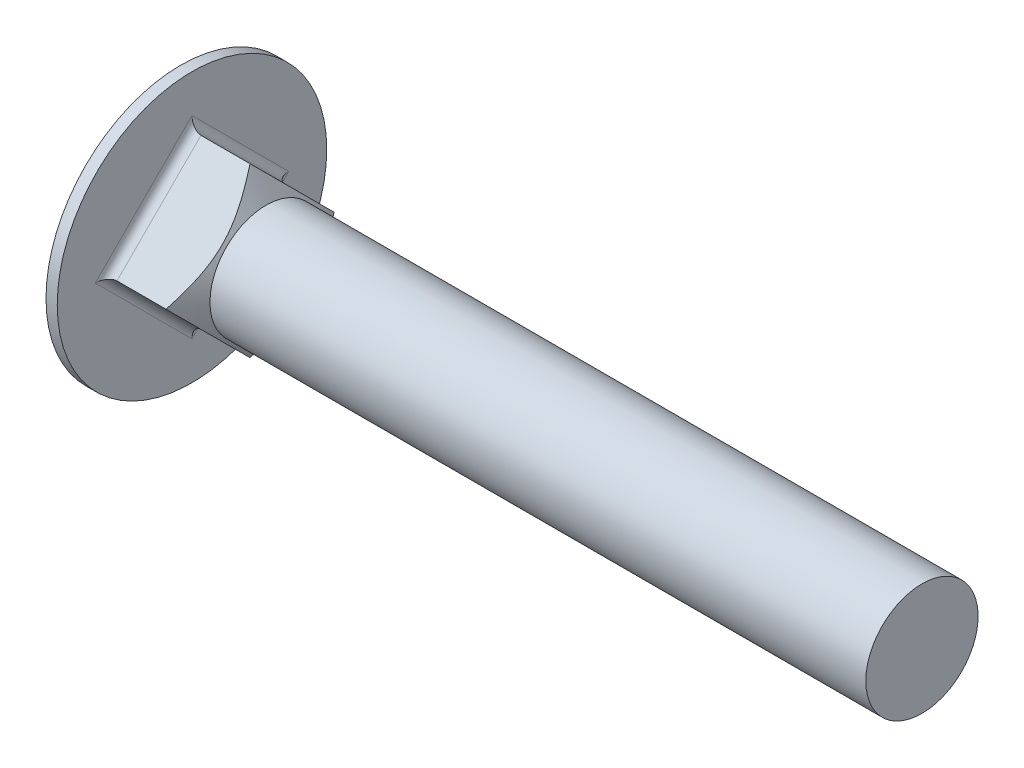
SolidWorks part; units mm, degrees
ref_plane "Front" through (0, 0, 0) normal (0, 0, 1) x (1, 0, 0)
ref_plane "Top" through (0, 0, 0) normal (0, 1, 0) x (1, 0, 0)
ref_plane "Right" through (0, 0, 0) normal (1, 0, 0) x (0, 0, -1)
other "Configuration Table"
sketch "Sketch1" plane through (0, 0, 0) normal (0, 0, 1) x (1, 0, 0)
  line L0 (-9.8282, 0) -> (16.3483, 0) construction
  line L1 (4, 12) -> (5, 12)
  line L2 (0, 0) -> (5, 0)
  line L3 (5, 12) -> (5, 0)
  arc A0 (4, 12) -> (0, 0) centre (20, 0) ccw
revolve "BaseHead" add sketch "Sketch1" angle 360 about L0
sketch "Sketch2" plane through (5, 0, 0) normal (1, 0, 0) x (0, 0, -1)
  line L1 (-7.4812, 0) -> (0, -7.4812)
  line L2 (0, -7.4812) -> (7.4812, 0)
  line L3 (7.4812, 0) -> (0, 7.4812)
  line L4 (0, 7.4812) -> (-7.4812, 0)
  circle A0 centre (0, 0) radius 5.29 construction
  dimension "Ss" = 10.58
extrude "Neck" add sketch "Sketch2" along normal blind 6.6
sketch "Sketch3" plane through (0, 0, 0) normal (0, 0, 1) x (1, 0, 0)
  line L0 (5, 0) -> (14.6279, 0) construction
  line L1 (11.6, 7.4812) -> (10.1675, 7.4812)
  line L3 (10.1675, 7.4812) -> (11.6, 5)
  line L5 (11.6, 5) -> (11.6, 7.4812)
  dimension "D1" = 30
revolve "Cut-Revolve1" cut sketch "Sketch3" angle 360 about L0
fillet "HeadFillet" radius 0.8 4 edges at (5, 3.7406, -3.7406) (5, -3.7406, -3.7406) (5, -3.7406, 3.7406) (5, 3.7406, 3.7406)
sketch "Sketch4" plane through (0, 0, 0) normal (0, 1, 0) x (1, 0, 0)
  line L0 (-12.2854, 0) -> (59.7905, 0) construction
  line L1 (70, 5) -> (44, 5)
  line L3 (44, 5) -> (11.6, 5)
  line L4 (5, -12) -> (5, 12) construction
  line L5 (70, 5) -> (70, 0)
  line L6 (70, 0) -> (11.6, 0)
  line L7 (11.6, 0) -> (11.6, 5)
  line L10 (11.6, -5) -> (11.6, 5) construction
revolve "Revolve1" add sketch "Sketch4" angle 360 about L0
sketch "Sketch5" plane through (0, 0, 0) normal (0, 0, 1) x (1, 0, 0)
  line L0 (69.594, 5.2) -> (70.406, 5.2)
  line L1 (70.406, 5.2) -> (70.406, 5)
  line L2 (70.406, 5) -> (70, 4.2968)
  line L3 (69.594, 5) -> (70, 4.2968)
  line L4 (69.594, 5.2) -> (69.594, 5)
  line L5 (-65.6461, 0) -> (65.6461, 0) construction
  line L6 (69.594, 5) -> (70.406, 5) construction
  line L7 (70, 5) -> (70, 4.2968) construction
  line L8 (70, -5) -> (70, 5) construction
  line L10 (70, 5) -> (11.6, 5) construction
  point P5 (70, 5.2)
revolve "Cut-Revolve10" [suppressed] cut sketch "Sketch5" angle 360 about L5
pattern_linear "LPattern10" [suppressed] count 27 spacing 0.9744 along (1, 0, 0)
equation "\"D2@Sketch5\" =  ( \"d@Sketch4\" - \"dn@ThreadCosmetic1\" )  / 2"
equation "\"D3@LPattern10\" = \"D2@Sketch5\" * 1.2"
equation "\"D1@LPattern10\" = \"b@Sketch4\" / \"D3@LPattern10\" "
equation "\"H@Sketch1\" = \"k@Sketch1\" / 5"
